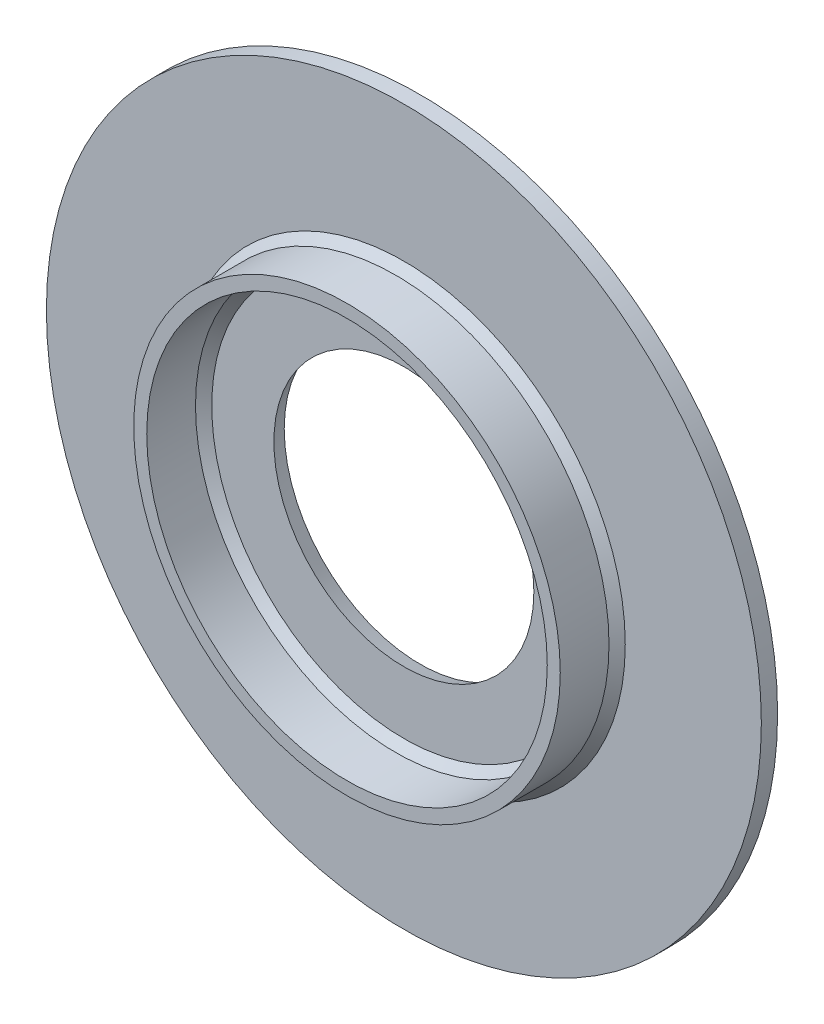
SolidWorks part; units mm, degrees
ref_plane "Top Plane" through (0, 0, 0) normal (0, 0, 1) x (1, 0, 0)
ref_plane "Front Plane" through (0, 0, 0) normal (0, 1, 0) x (1, 0, 0)
ref_plane "Right Plane" through (0, 0, 0) normal (1, 0, 0) x (0, 0, -1)
sketch "Sketch1" plane through (0, 0, 0) normal (0, 0, 1) x (1, 0, 0)
  circle A0 centre (0, 0) radius 44
  circle A1 centre (0, 0) radius 16
  dimension "D1" = 88
  dimension "D2" = 32
extrude "Boss-Extrude1" add sketch "Sketch1" along normal blind 2
sketch "Sketch2" plane through (0, 0, 2) normal (0, 0, 1) x (1, 0, 0)
  circle A0 centre (0, 0) radius 26.25
  circle A1 centre (0, 0) radius 24.65
  dimension "D1" = 52.5
  dimension "D2" = 1.6
extrude "Boss-Extrude3" add sketch "Sketch2" along normal blind 7
chamfer "Chamfer2" distance 2 angle 20 1 edges at (16, 0, 0)
chamfer "Chamfer3" distance 1 angle 45 1 edges at (24.65, 0, 2)
chamfer "Chamfer4" distance 1 angle 45 1 edges at (26.25, 0, 2)
sketch "Sketch4" plane through (0, 0, 0) normal (0, 0, -1) x (-1, 0, 0)
  line L0 (0, 48.9688) -> (0, -48.9688) construction
  line L1 (-18.4785, 32) -> (18.4785, 32) construction
  text T0 "X3D  53mm" font "Trebuchet MS" height 3.5
  point P5 (0, 0)
  point P9 (0, 32)
  dimension "D1" = 32
extrude "Cut-Extrude1" cut sketch "Sketch4" against normal blind 0.4
